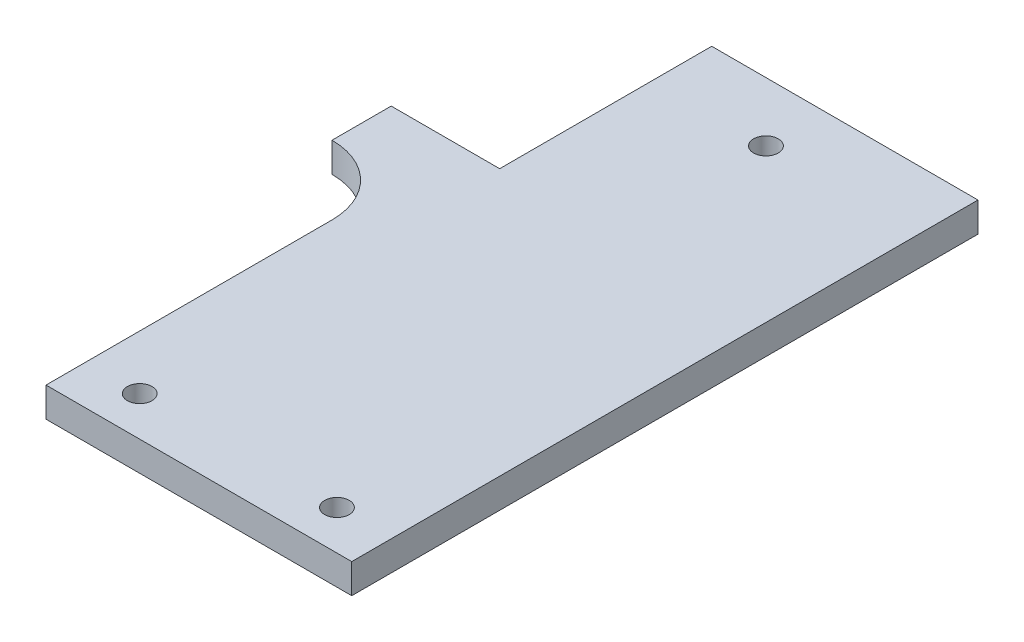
SolidWorks part; units mm, degrees
ref_plane "Front Plane" through (0, 0, 0) normal (0, 0, 1) x (1, 0, 0)
ref_plane "Top Plane" through (0, 0, 0) normal (0, 1, 0) x (1, 0, 0)
ref_plane "Right Plane" through (0, 0, 0) normal (1, 0, 0) x (0, 0, -1)
sketch "Sketch1" plane through (0, 0, 0) normal (0, 1, 0) x (1, 0, 0)
  line L0 (8, 127) -> (8, 84)
  line L1 (0, 0) -> (62, 0)
  line L2 (0, 0) -> (0, 58)
  line L3 (8, 127) -> (62, 127)
  line L4 (62, 0) -> (62, 127)
  line L5 (8, 84) -> (-14, 84)
  line L6 (-14, 84) -> (-14, 72)
  arc A0 (0, 58) -> (-14, 72) centre (-14, 58) ccw
  dimension "D1" = 14
  dimension "D2" = 12
  dimension "D3" = 14
  dimension "D4" = 62
  dimension "D5" = 54
  dimension "D6" = 43
  dimension "D7" = 84
extrude "Extrude1" add sketch "Sketch1" along normal blind 6
sketch "Sketch2" plane through (0, 6, 0) normal (0, 1, 0) x (1, 0, 0)
  line L0 (31, 0) -> (31, 127) construction
  line L1 (0, 0) -> (62, 0) construction
  line L2 (62, 127) -> (8, 127) construction
  line L3 (0, 8) -> (62, 8) construction
  line L4 (0, 58) -> (0, 0) construction
  line L5 (62, 0) -> (62, 127) construction
  point P12 (11, 8)
  point P13 (51, 8)
  point P14 (31, 115)
  dimension "D1" = 8
  dimension "D2" = 11
  dimension "D3" = 11
  dimension "D4" = 12
hole_wizard "M6 Tapped Hole1" positions "3DSketch1" profile "Sketch3" tap size "M6" standard "ISO"
sketch3d "3DSketch1"
  point P0 (31, 6, -115)
  point P3 (11, 6, -8)
  point P6 (51, 6, -8)
sketch "Sketch3" plane through (31, 6, -115) normal (1, 0, 0) x (0, 0, 1)
  line L0 (0, 0) -> (0, 6)
  line L1 (0, 6) -> (2.5, 6)
  line L2 (2.5, 6) -> (2.5, 0)
  line L5 (2.5, 0) -> (0, 0)
  line L11 (0, -6.35) -> (0, 107.95) construction
  dimension "Thru Tap Drill Dia." = 5
  dimension "Thru Tap Drill Depth" = 6
